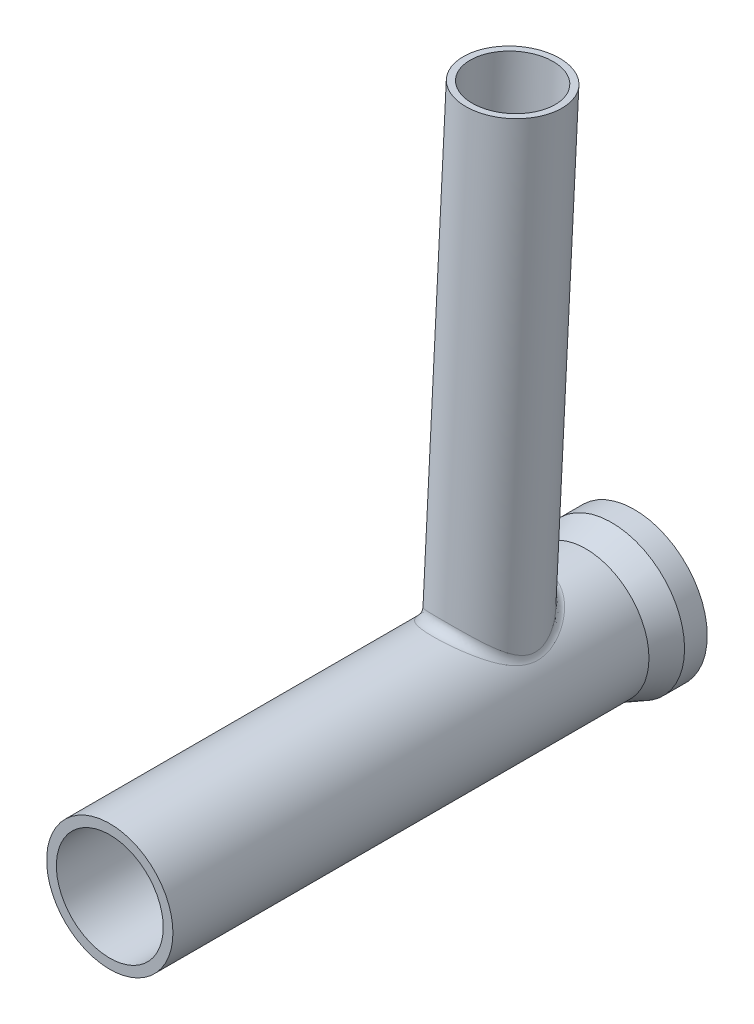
SolidWorks part; units mm, degrees
ref_plane "Front Plane" through (0, 0, 0) normal (0, 0, 1) x (1, 0, 0)
ref_plane "Top Plane" through (0, 0, 0) normal (0, 1, 0) x (1, 0, 0)
ref_plane "Right Plane" through (0, 0, 0) normal (1, 0, 0) x (0, 0, -1)
sketch "Sketch1" plane through (0, 0, 0) normal (0, 1, 0) x (1, 0, 0)
  line L0 (0, -59.468) -> (0, 76.6636) construction
  line L1 (22.5, 0) -> (22.5, -7)
  line L2 (22.5, -7) -> (19.5, -15)
  line L3 (19.5, -15) -> (19.5, -162)
  line L4 (19.5, 0) -> (19.5, -6.456)
  line L5 (19.5, -6.456) -> (16.5, -14.456)
  line L6 (16.5, -14.456) -> (16.5, -162)
  line L7 (19.5, 0) -> (22.5, 0)
  line L8 (16.5, -162) -> (19.5, -162)
  line L9 (-58.7891, 0) -> (51.6958, 0) construction
  dimension "D2" = 19.5
  dimension "D3" = 8
  dimension "D4" = 22.5
  dimension "D5" = 7
  dimension "D6" = 162
  dimension "D1" = 3
revolve "Revolve1" add sketch "Sketch1" angle 360 about L0
sketch "Sketch5" plane through (0, 0, 0) normal (1, 0, 0) x (0, 0, -1)
  line L0 (-44.7199, 19.5) -> (-36.5048, 176.2535) construction
  line L1 (-15, 19.5) -> (-162, 19.5) construction
  line L2 (-15, -19.5) -> (-15, 105.5032) construction
  line L3 (-23.1113, 154.7601) -> (-31.3857, -3.124)
  line L4 (-23.1113, 154.7601) -> (-25.1086, 154.8648)
  line L5 (-33.3829, -3.0193) -> (-31.3857, -3.124)
  line L6 (-25.1086, 154.8648) -> (-33.3829, -3.0193)
  line L9 (-162, 19.5) -> (-162, -19.5) construction
  line L11 (-162, 19.5) -> (-15, 19.5) construction
  point P9 (-30.2, 19.5)
  dimension "D1" = 3
  dimension "D2" = 15.2
  dimension "D3" = 2
  dimension "D4" = 14.5
revolve "Revolve2" add sketch "Sketch5" angle 360 about L0
sketch "Sketch6" plane through (0, 0, 162) normal (0, 0, 1) x (1, 0, 0)
  circle A0 centre (0, 0) radius 16.5 construction
  circle A1 centre (0, 0) radius 16.5
extrude "Cut-Extrude1" cut sketch "Sketch6" against normal through all
fillet "Fillet1" radius 3 1 edges at (2.7918, 19.2991, 58.9787)
